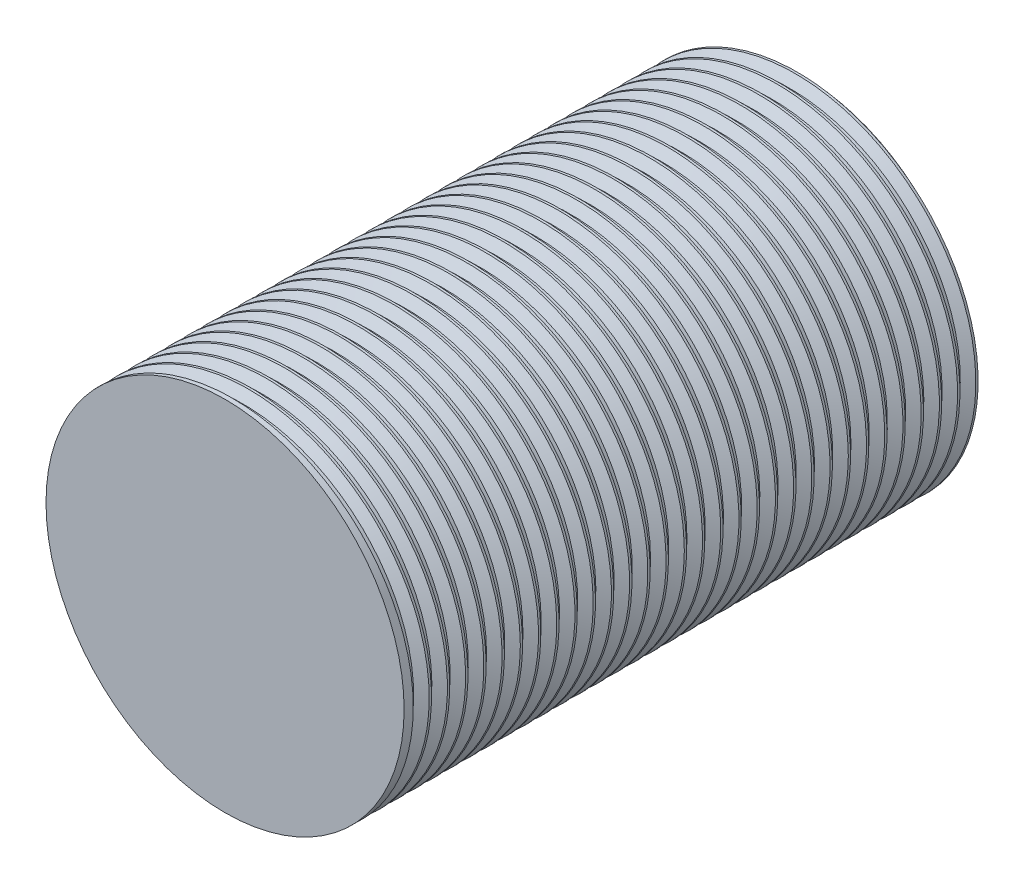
SolidWorks part; units mm, degrees
ref_plane "Front Plane" through (0, 0, 0) normal (0, 0, 1) x (1, 0, 0)
ref_plane "Top Plane" through (0, 0, 0) normal (0, 1, 0) x (1, 0, 0)
ref_plane "Right Plane" through (0, 0, 0) normal (1, 0, 0) x (0, 0, -1)
sketch "Sketch1" plane through (0, 0, 0) normal (0, 0, 1) x (1, 0, 0)
  circle A2 centre (-655.0821, 876.4135) radius 7.8613
extrude "Boss-Extrude1" add sketch "Sketch1" along normal blind 25.4
thread "Thread1" pitch 0.8 start angle 0, offset 0, length 0, pitch 0.8, diameter 15.7226
ref_plane "Plane1" through (-662.9434, 876.4135, 25.4) normal (0, -1, 0) x (-1, 0, 0)
sketch "Thread Profile1" plane through (-662.9434, 876.4135, 25.4) normal (0, -1, 0) x (-1, 0, 0)
  line L0 (0, 0) -> (0, 0.8) construction
  line L11 (0, 0) -> (0, 0.7)
  line L12 (0, 0.7) -> (-0.433, 0.45)
  line L13 (-0.433, 0.45) -> (-0.433, 0.25)
  line L15 (-0.433, 0.25) -> (0, 0)
  line L17 (-0.433, 0.35) -> (0, 0.35) construction
  point P2 (0, 0)
  dimension "Pitch" = 0.8
  dimension "Profile_Angle" = 60
  dimension "Profile_Land" = 0.2
  dimension "Profile_Height" = 0.433
